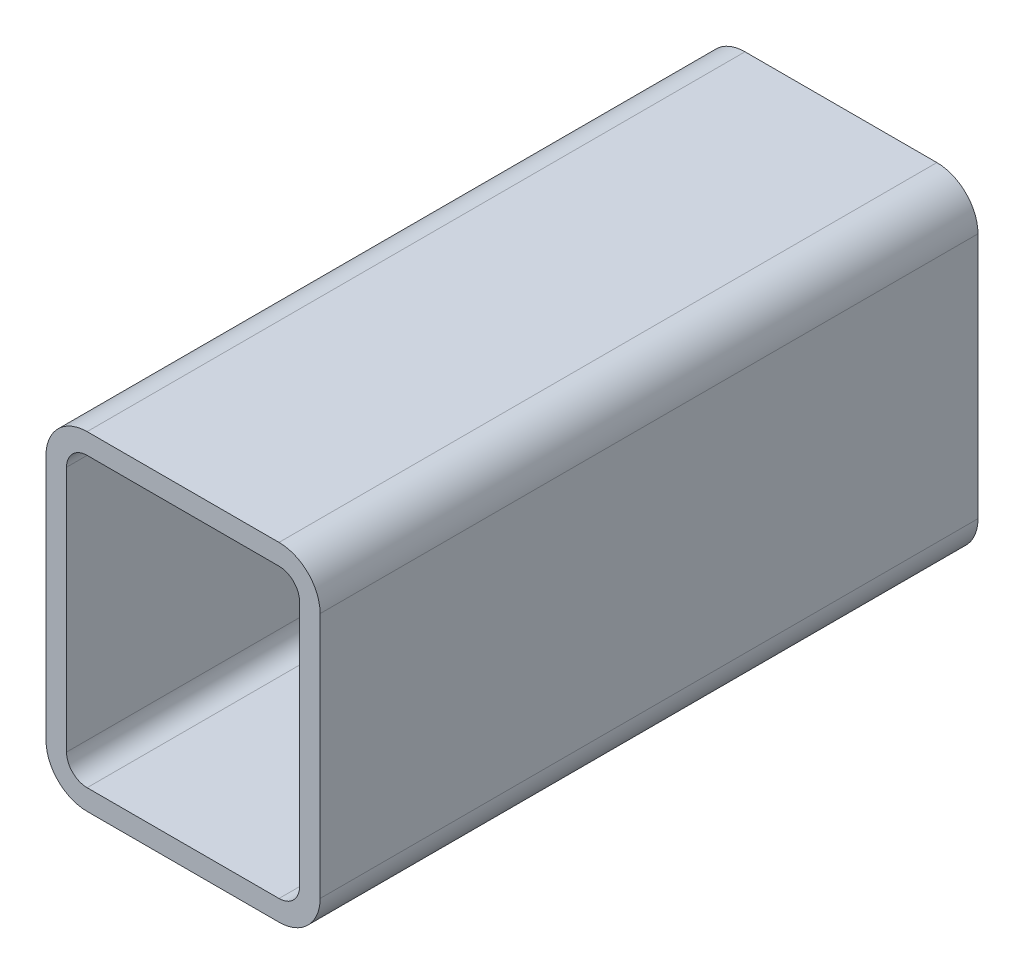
SolidWorks part; units mm, degrees
ref_plane "Front Plane" through (0, 0, 0) normal (0, 0, 1) x (1, 0, 0)
ref_plane "Top Plane" through (0, 0, 0) normal (0, 1, 0) x (1, 0, 0)
ref_plane "Right Plane" through (0, 0, 0) normal (1, 0, 0) x (0, 0, -1)
sketch "Sketch1" plane through (0, 0, 0) normal (0, 0, 1) x (1, 0, 0)
sketch_block_instance "HSS6x5x0.375-1"
sketch_block "HSS6x5x0.375"
extrude "Boss-Extrude1" add sketch "Sketch1" along normal blind 304.8
